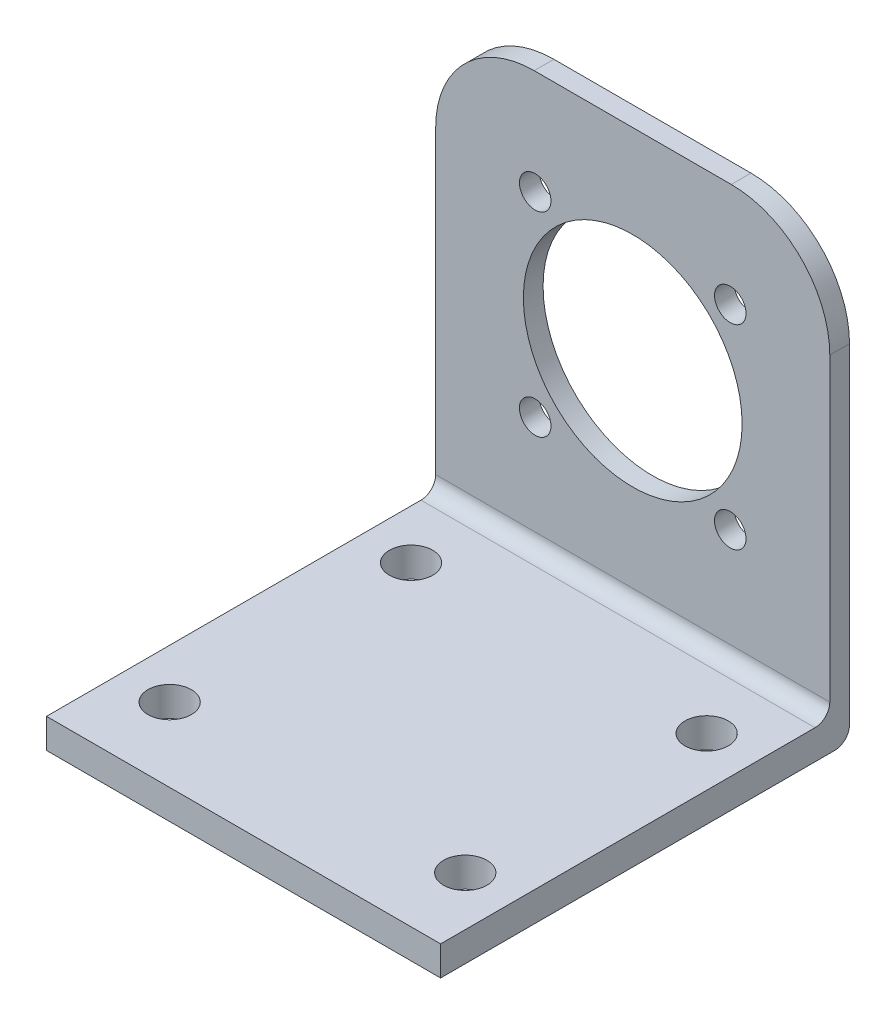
SolidWorks part; units mm, degrees
ref_plane "前视基准面" through (0, 0, 0) normal (0, 0, 1) x (1, 0, 0)
ref_plane "上视基准面" through (0, 0, 0) normal (0, 1, 0) x (1, 0, 0)
ref_plane "右视基准面" through (0, 0, 0) normal (1, 0, 0) x (0, 0, -1)
sketch "草图1" plane through (0, 0, 0) normal (0, 0, 1) x (1, 0, 0)
  line L0 (0, 2) -> (0, 0) construction
  line L1 (10, 22.5) -> (-10, 22.5)
  line L2 (20, 12.5) -> (20, -22.5)
  line L3 (20, -22.5) -> (-20, -22.5)
  line L4 (-20, 12.5) -> (-20, -22.5)
  line L5 (20, 22.5) -> (-20, -22.5) construction
  line L6 (20, -22.5) -> (-20, 22.5) construction
  arc A0 (10, 22.5) -> (20, 12.5) centre (10, 12.5) cw
  arc A1 (-10, 22.5) -> (-20, 12.5) centre (-10, 12.5) ccw
  circle A3 centre (0, 2) radius 11.1
  point P0 (0, 0)
  dimension "D3" = 10
  dimension "D4" = 24.5
  dimension "D5" = 22.2
  dimension "D1" = 45
  dimension "D2" = 40
extrude "凸台-拉伸1" add sketch "草图1" along normal blind 2
sketch "草图2" plane through (20, 0, 0) normal (1, 0, 0) x (0, 0, -1)
  line L1 (0, -22.5) -> (-41.5, -22.5)
  line L2 (0, -22.5) -> (0, -19.5)
  line L3 (0, -19.5) -> (-41.5, -19.5)
  line L4 (-41.5, -22.5) -> (-41.5, -19.5)
  dimension "D1" = 3
  dimension "D2" = 41.5
extrude "凸台-拉伸2" add sketch "草图2" against normal up to surface (40 mm away)
fillet "圆角1" radius 1.5 2 edges at (0, -22.5, 0) (0, -19.5, 2)
sketch "草图4" plane through (0, -19.5, 0) normal (0, 1, 0) x (1, 0, 0)
  line L0 (-20, -41.5) -> (-20, -3.5) construction
  line L1 (-20, -41.5) -> (20, -41.5) construction
  line L2 (0, -41.5) -> (0, 0) construction
  line L3 (15, -9.5) -> (15, -34) construction
  circle A0 centre (-15, -34) radius 2.2
  circle A1 centre (-15, -9.5) radius 2.2
  circle A2 centre (15, -9.5) radius 2.2
  circle A3 centre (15, -34) radius 2.2
  dimension "D1" = 4.4
  dimension "D2" = 4.4
  dimension "D3" = 5
  dimension "D4" = 5
  dimension "D5" = 7.5
  dimension "D6" = 24.5
extrude "切除-拉伸1" cut sketch "草图4" against normal blind 3
sketch "草图6" plane through (0, 0, 2) normal (0, 0, 1) x (1, 0, 0)
  line L0 (0, 2) -> (31.0404, 2) construction
  line L1 (0, 2) -> (0, -18) construction
  line L2 (-20, -18) -> (20, -18) construction
  line L3 (-20, -22.5) -> (20, -22.5) construction
  line L4 (0, 2) -> (9.8995, 11.8995) construction
  circle A0 centre (9.8995, 11.8995) radius 1.6
  circle A1 centre (9.8995, -7.8995) radius 1.6
  circle A2 centre (-9.8995, -7.8995) radius 1.6
  circle A3 centre (-9.8995, 11.8995) radius 1.6
  point P18 (0, 2)
  dimension "D4" = 3.2
  dimension "D1" = 24.5
  dimension "D2" = 45
  dimension "D3" = 14
  dimension "D5" = 4
extrude "切除-拉伸3" cut sketch "草图6" against normal blind 3
